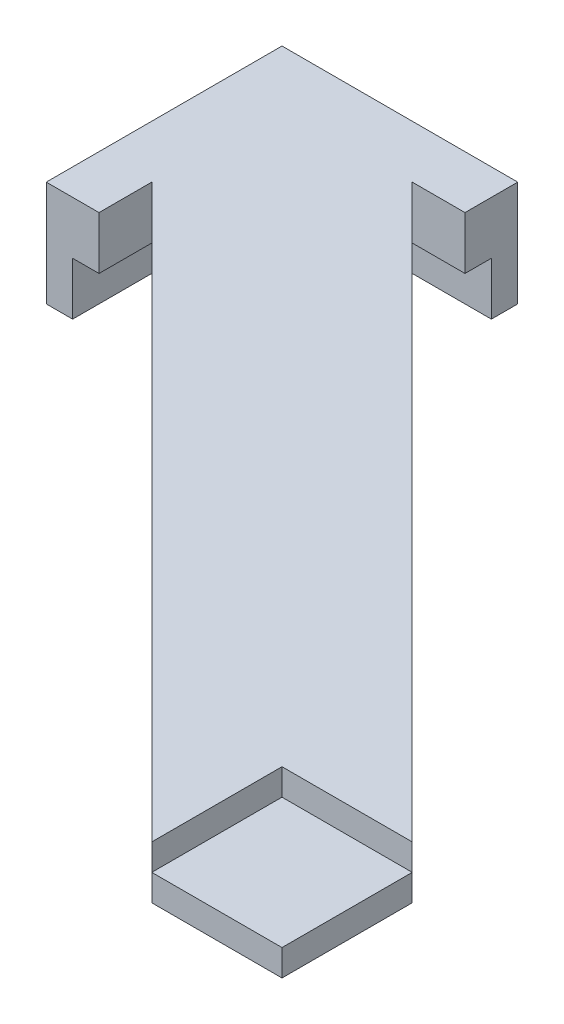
SolidWorks part; units mm, degrees
ref_plane "Front Plane" through (0, 0, 0) normal (0, 0, 1) x (1, 0, 0)
ref_plane "Top Plane" through (0, 0, 0) normal (0, 1, 0) x (1, 0, 0)
ref_plane "Right Plane" through (0, 0, 0) normal (1, 0, 0) x (0, 0, -1)
sketch "Sketch1" plane through (0, 0, 0) normal (0, 1, 0) x (1, 0, 0)
  line L0 (0, 0) -> (0, 69) construction
  line L1 (0, 69) -> (69, 69) construction
  line L2 (69, 69) -> (69, 0) construction
  line L3 (69, 0) -> (0, 0) construction
  line L5 (19.8431, 71.5) -> (19.8431, 66.5)
  line L6 (19.8431, 66.5) -> (14.8431, 66.5)
  line L7 (14.8431, 66.5) -> (69, 12.3431)
  line L8 (69, 12.3431) -> (69, 0)
  line L9 (69, 0) -> (56.6569, 0)
  line L10 (56.6569, 0) -> (2.5, 54.1569)
  line L11 (2.5, 54.1569) -> (2.5, 49.1569)
  line L12 (2.5, 49.1569) -> (-2.5, 49.1569)
  line L14 (-2.5, 49.1569) -> (-2.5, 71.5)
  line L15 (-2.5, 71.5) -> (19.8431, 71.5)
  point P4 (19.8431, 69)
  point P14 (0, 49.1569)
  dimension "D1" = 69
  dimension "D2" = 69
  dimension "D3" = 20
  dimension "D4" = 20
  dimension "D5" = 5
  dimension "D6" = 45
  dimension "D7" = 5
extrude "Boss-Extrude1" add sketch "Sketch1" along normal blind 5
sketch "Sketch2" plane through (0, 5, 0) normal (0, 1, 0) x (1, 0, 0)
  line L0 (56.6569, 0) -> (56.6569, 12.3431)
  line L1 (56.6569, 12.3431) -> (69, 12.3431)
  line L4 (69, 0) -> (69, 12.3431) construction
  line L5 (56.6569, 0) -> (69, 0) construction
  line L6 (69, 0) -> (69, 12.3431)
  line L7 (56.6569, 0) -> (69, 0)
extrude "Cut-Extrude1" cut sketch "Sketch2" against normal blind 2.5
sketch "Sketch3" plane through (0, 0, 0) normal (0, -1, 0) x (1, 0, 0)
  line L0 (19.8431, -66.5) -> (19.8431, -71.5) construction
  line L1 (-2.5, -49.1569) -> (2.5, -49.1569) construction
  line L2 (19.8431, -71.5) -> (-2.5, -71.5) construction
  line L3 (-2.5, -71.5) -> (-2.5, -49.1569) construction
  line L4 (19.8431, -69) -> (19.8431, -71.5)
  line L5 (-2.5, -49.1569) -> (0, -49.1569)
  line L6 (19.8431, -71.5) -> (-2.5, -71.5)
  line L7 (-2.5, -71.5) -> (-2.5, -49.1569)
  line L8 (0, -49.1569) -> (0, -69)
  line L9 (19.8431, -69) -> (0, -69)
extrude "Boss-Extrude2" add sketch "Sketch3" along normal blind 5
